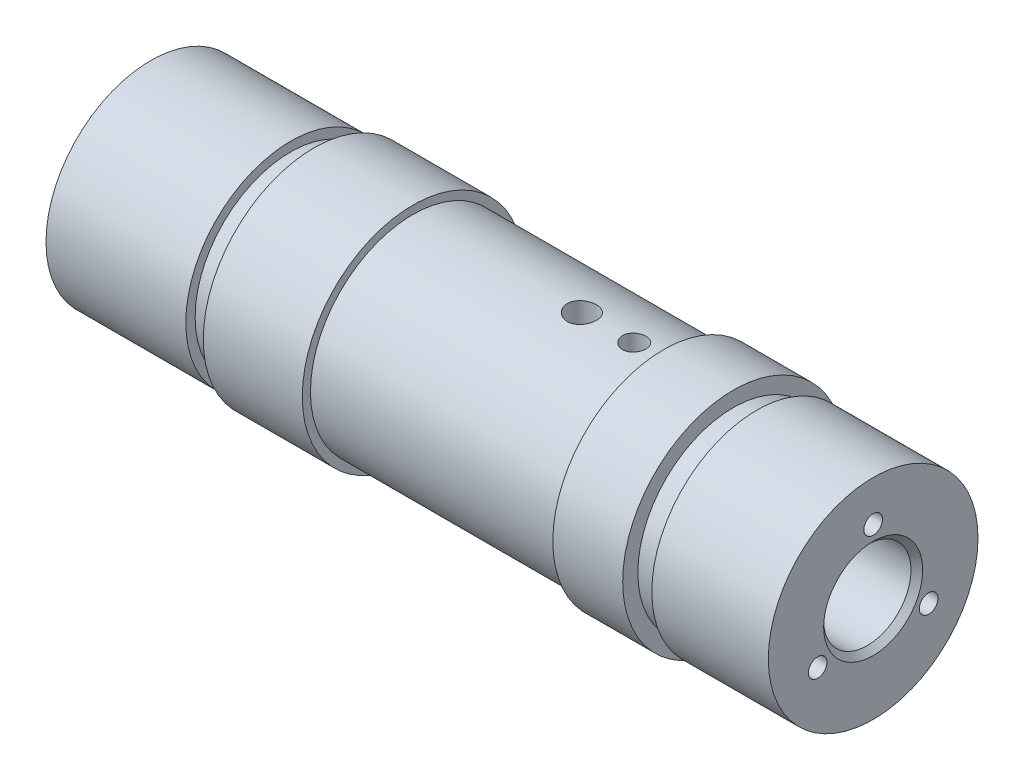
SolidWorks part; units mm, degrees
ref_plane "Vorne" through (0, 0, 0) normal (0, 0, 1) x (1, 0, 0)
ref_plane "Oben" through (0, 0, 0) normal (0, 1, 0) x (1, 0, 0)
ref_plane "Rechts" through (0, 0, 0) normal (1, 0, 0) x (0, 0, -1)
sketch "Skizze1" plane through (0, 0, 0) normal (0, 0, 1) x (1, 0, 0)
  line L0 (46.695, 9.5) -> (46.695, 8.8) construction
  line L1 (52.695, 9.5) -> (46.695, 9.5) construction
  line L2 (52.695, 8.2) -> (52.695, 9.5) construction
  line L3 (54.695, 8.2) -> (52.695, 8.2) construction
  line L4 (54.695, 9) -> (54.695, 8.2) construction
  line L6 (0, 0) -> (79.1682, 0) construction
  line L8 (64.195, 3.75) -> (64.695, 4.25) construction
  line L9 (53.695, 3.75) -> (64.195, 3.75) construction
  line L10 (14.44, 3) -> (26.7353, 3) construction
  line L11 (25.19, 8.8) -> (46.695, 8.8) construction
  line L12 (25.19, 9.5) -> (25.19, 8.8) construction
  line L13 (25.19, 9.5) -> (16.69, 9.5) construction
  line L14 (16.69, 9.5) -> (16.69, 8.2) construction
  line L15 (16.69, 8.2) -> (14.69, 8.2) construction
  line L16 (14.69, 8.2) -> (14.69, 9) construction
  line L17 (26.7353, 2.5) -> (42.7, 2.5) construction
  line L18 (26.7353, 3) -> (26.7353, 2.5) construction
  line L19 (64.695, 9) -> (54.695, 9) construction
  line L20 (10.19, 3.65) -> (10.19, 3.2) construction
  line L21 (2.69, 3.65) -> (10.19, 3.65) construction
  line L22 (64.695, 4.25) -> (64.695, 9) construction
  line L23 (14.69, 9) -> (2.69, 9) construction
  line L24 (2.69, 9) -> (2.69, 3.65) construction
  line L25 (64.695, 9) -> (54.695, 9)
  line L26 (46.695, 9.5) -> (46.695, 8.8)
  line L27 (52.695, 9.5) -> (46.695, 9.5)
  line L28 (52.695, 8.2) -> (52.695, 9.5)
  line L29 (54.695, 8.2) -> (52.695, 8.2)
  line L30 (54.695, 9) -> (54.695, 8.2)
  line L31 (64.695, 4.25) -> (64.695, 9)
  line L32 (0, 0) -> (79.1682, 0) construction
  line L34 (64.195, 3.75) -> (64.695, 4.25)
  line L35 (53.695, 3.75) -> (64.195, 3.75)
  line L36 (53.695, 3) -> (53.695, 3.75) construction
  line L37 (25.19, 8.8) -> (46.695, 8.8)
  line L38 (25.19, 9.5) -> (25.19, 8.8)
  line L39 (25.19, 9.5) -> (16.69, 9.5)
  line L40 (16.69, 9.5) -> (16.69, 8.2)
  line L41 (16.69, 8.2) -> (14.69, 8.2)
  line L42 (14.69, 8.2) -> (14.69, 9)
  line L43 (26.7353, 2.5) -> (42.7, 2.5)
  line L44 (26.7353, 3) -> (26.7353, 2.5)
  line L45 (14.44, 3) -> (14.44, 3.6) construction
  line L46 (10.19, 3.65) -> (10.19, 3.2)
  line L47 (2.69, 3.65) -> (10.19, 3.65)
  line L48 (13.64, 3.6) -> (14.44, 3.6) construction
  line L49 (14.69, 9) -> (2.69, 9)
  line L50 (2.69, 9) -> (2.69, 3.65)
  line L51 (13.64, 3.2) -> (13.64, 3.6) construction
  line L52 (42.7, 2.5) -> (42.7, 3) construction
  line L53 (53.695, 3) -> (42.7, 3) construction
  line L54 (42.7, 2.5) -> (42.7, 3)
  line L55 (53.695, 3) -> (42.7, 3)
  line L56 (53.695, 3) -> (53.695, 3.75)
  line L57 (10.19, 3.2) -> (13.64, 3.2) construction
  line L58 (14.44, 3) -> (26.7353, 3)
  line L59 (14.44, 3) -> (14.44, 3.6)
  line L60 (13.64, 3.6) -> (14.44, 3.6)
  line L61 (13.64, 3.2) -> (13.64, 3.6)
  line L62 (10.19, 3.2) -> (13.64, 3.2)
revolve "Rotation1" add sketch "Skizze1" angle 360 about L32
sketch "Skizze2" plane through (0, 0, 0) normal (0, 1, 0) x (1, 0, 0)
  line L0 (0, 0) -> (79.1682, 0) construction
  line L1 (2.69, 9) -> (2.69, -9) construction
  circle A0 centre (44.19, 0) radius 1
  dimension "D2" = 2
  dimension "D1" = 41.5
extrude "Schnitt-Linear austragen1" cut sketch "Skizze2" against normal mid plane 31
hole_wizard "M2 Gewindebohrung1" positions "Skizze4" profile "Skizze3" tap size "M2" standard "ISO"
sketch "Skizze4" plane through (64.695, 0, 0) normal (1, 0, 0) x (0, 0, -1)
  line L0 (-4.7631, -2.75) -> (0, 0) construction
  line L1 (0, 0) -> (4.7631, -2.75) construction
  line L3 (0, 0) -> (0, 5.5) construction
  circle A0 centre (0, 0) radius 5.5 construction
  point P0 (-4.7631, -2.75)
  point P1 (4.7631, -2.75)
  point P3 (0, 5.5)
  dimension "D3" = 11
  dimension "D1" = 120
  dimension "D2" = 120
sketch "Skizze3" plane through (64.695, -2.75, 4.7631) normal (0, 1, 0) x (0, 0, -1)
  line L0 (0, 0) -> (0, 7.4807)
  line L1 (0, 7.4807) -> (0.8, 7)
  line L2 (0.8, 7) -> (0.8, 0)
  line L5 (0.8, 0) -> (0, 0)
  line L10 (0, 7.4807) -> (-0.8, 7) construction
  line L11 (0, -6.35) -> (0, 107.95) construction
  dimension "Bohrerdurchmesser" = 1.6
  dimension "Bohrungstiefe" = 7
  dimension "Spitzenwinkel" = 118
hole_wizard "M2 Gewindebohrung2" positions "Skizze6" profile "Skizze5" tap size "M2" standard "ISO"
sketch "Skizze6" plane through (2.69, 0, 0) normal (-1, 0, 0) x (0, 0, 1)
  circle A0 centre (0, 0) radius 6.25 construction
  point P1 (0, 6.25)
  point P5 (0, -6.25)
  dimension "D1" = 12.5
sketch "Skizze5" plane through (2.69, 6.25, 0) normal (0, 1, 0) x (0, 0, 1)
  line L0 (0, 0) -> (0, 7.4807)
  line L1 (0, 7.4807) -> (0.8, 7)
  line L2 (0.8, 7) -> (0.8, 0)
  line L5 (0.8, 0) -> (0, 0)
  line L10 (0, 7.4807) -> (-0.8, 7) construction
  line L11 (0, -6.35) -> (0, 107.95) construction
  dimension "Bohrerdurchmesser" = 1.6
  dimension "Bohrungstiefe" = 7
  dimension "Spitzenwinkel" = 118
hole_wizard "M3 Gewindebohrung1" positions "Skizze9" profile "Skizze8" tap size "M3" standard "ISO"
sketch "Skizze9" plane through (0, 0, 0) normal (0, 1, 0) x (1, 0, 0)
  line L0 (2.69, 9) -> (2.69, -9) construction
  line L1 (0, 0) -> (79.1682, 0) construction
  point P0 (39.69, 0)
  dimension "D1" = 37
sketch "Skizze8" plane through (39.69, 0, 0) normal (1, 0, 0) x (0, 0, -1)
  line L0 (0, 0) -> (0, 9.5)
  line L1 (0, 9.5) -> (1.25, 9.5)
  line L2 (1.25, 9.5) -> (1.25, 0)
  line L5 (1.25, 0) -> (0, 0)
  line L11 (0, -6.35) -> (0, 107.95) construction
  dimension "Bohrerdurchmesser" = 2.5
  dimension "Bohrungstiefe" = 9.5
chamfer "Fase1" distance 0.2 angle 45 1 edges at (53.695, 0, 3)
sketch "Skizze12" plane through (0, 0, 0) normal (0, 0, 1) x (1, 0, 0)
  line L0 (64.195, 0) -> (53.695, 0) construction
  line L1 (53.695, 3.5) -> (55.695, 3.5)
  line L2 (53.695, 3.5) -> (53.695, 4.1)
  line L3 (53.695, 4.1) -> (55.695, 4.1)
  line L4 (55.695, 3.5) -> (55.695, 4.1)
  line L5 (53.695, 3) -> (53.695, 3.75) construction
  dimension "D1" = 4.1
  dimension "D2" = 3.5
  dimension "D3" = 2
revolve "Schnitt-Rotation1" cut sketch "Skizze12" angle 360 about L32
hole_wizard "M2 Gewindebohrung3" positions "Skizze14" profile "Skizze13" tap size "M2" standard "ISO"
sketch "Skizze14" plane through (2.69, 0, 0) normal (-1, 0, 0) x (0, 0, 1)
  circle A0 centre (0, 0) radius 6
  point P0 (6, 0)
  point P1 (-6, 0)
  dimension "D1" = 12
sketch "Skizze13" plane through (2.69, 0, 6) normal (0, 1, 0) x (0, 0, 1)
  line L0 (0, 0) -> (0, 7.4807)
  line L1 (0, 7.4807) -> (0.8, 7)
  line L2 (0.8, 7) -> (0.8, 0)
  line L5 (0.8, 0) -> (0, 0)
  line L10 (0, 7.4807) -> (-0.8, 7) construction
  line L11 (0, -6.35) -> (0, 107.95) construction
  dimension "Bohrerdurchmesser" = 1.6
  dimension "Bohrungstiefe" = 7
  dimension "Spitzenwinkel" = 118
